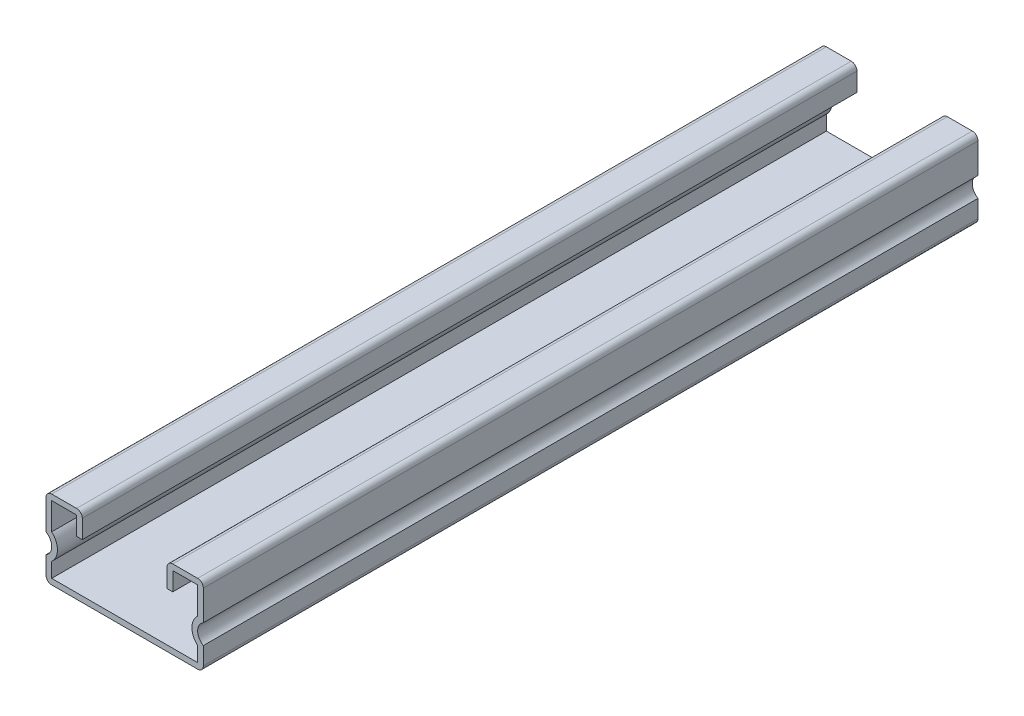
SolidWorks part; units mm, degrees
ref_plane "Plane1" through (0, 0, 0) normal (0, 0, 1) x (1, 0, 0)
ref_plane "Plane2" through (0, 0, 0) normal (0, 1, 0) x (1, 0, 0)
ref_plane "Plane3" through (0, 0, 0) normal (1, 0, 0) x (0, 0, -1)
sketch "Sketch1" plane through (0, 0, 0) normal (0, 0, 1) x (1, 0, 0)
  line L0 (-20.6375, 10.4394) -> (-20.6375, 2.5957)
  line L1 (-20.6375, -2.5957) -> (-20.6375, -7.2136)
  line L2 (-19.1389, -8.7122) -> (19.1389, -8.7122)
  line L3 (20.6375, -7.2136) -> (20.6375, -2.5957)
  line L4 (20.6375, 2.5957) -> (20.6375, 10.4394)
  line L5 (19.1389, 11.938) -> (12.6111, 11.938)
  line L6 (11.1125, 10.4394) -> (11.1125, 5.588)
  line L7 (-19.1389, 11.938) -> (-12.6111, 11.938)
  line L8 (-11.1125, 10.4394) -> (-11.1125, 5.588)
  line L9 (19.1389, -5.2823) -> (19.1389, 6.4389) construction
  line L10 (-19.1389, 6.4389) -> (-19.1389, -5.2823) construction
  line L11 (-12.6111, 10.4394) -> (-12.6111, 5.588)
  line L12 (-19.1389, 10.4394) -> (-12.6111, 10.4394)
  line L13 (-19.1389, 10.4394) -> (-19.1389, 3.351)
  line L14 (-19.1389, -3.351) -> (-19.1389, -7.2136)
  line L15 (-19.1389, -7.2136) -> (19.1389, -7.2136)
  line L16 (19.1389, -7.2136) -> (19.1389, -3.351)
  line L17 (19.1389, 3.351) -> (19.1389, 10.4394)
  line L18 (19.1389, 10.4394) -> (12.6111, 10.4394)
  line L19 (12.6111, 10.4394) -> (12.6111, 5.588)
  line L20 (-12.6111, 5.588) -> (-11.1125, 5.588)
  line L21 (11.1125, 5.588) -> (12.6111, 5.588)
  arc A0 (20.6375, 2.5957) -> (20.6375, -2.5957) centre (22.1361, 0) ccw
  arc A1 (-20.6375, -2.5957) -> (-20.6375, 2.5957) centre (-22.1361, 0) ccw
  arc A2 (-12.6111, 11.938) -> (-11.1125, 10.4394) centre (-12.6111, 10.4394) cw
  arc A3 (-20.6375, 10.4394) -> (-19.1389, 11.938) centre (-19.1389, 10.4394) cw
  arc A4 (-19.1389, -8.7122) -> (-20.6375, -7.2136) centre (-19.1389, -7.2136) cw
  arc A5 (20.6375, -7.2136) -> (19.1389, -8.7122) centre (19.1389, -7.2136) cw
  arc A6 (19.1389, 11.938) -> (20.6375, 10.4394) centre (19.1389, 10.4394) cw
  arc A7 (11.1125, 10.4394) -> (12.6111, 11.938) centre (12.6111, 10.4394) cw
  arc A8 (-19.1389, -3.351) -> (-19.1389, 3.351) centre (-22.1361, 0) ccw
  arc A9 (19.1389, 3.351) -> (19.1389, -3.351) centre (22.1361, 0) ccw
  dimension "D1" = 20.6375
  dimension "D9" = 2.9972
  dimension "D10" = 2.9972
  dimension "Width" = 41.275
  dimension "base" = 8.7122
  dimension "ToeHt" = 11.938
  dimension "D6" = 22.225
  dimension "edge" = 9.525
  dimension "Lip" = 6.35
  dimension "gauge" = 1.4986
extrude "Base-Extrude" add sketch "Sketch1" along normal blind 203.2
extrude "Slot" cut sketch "Sketch2" against normal through all
sketch "Sketch2" plane through (-0.7476, -8.7122, -11.6779) normal (0, -1, 0) x (1, 0, 0)
  line L0 (5.907, 90.2591) -> (5.907, 24.3779)
  line L1 (-4.4118, 24.3779) -> (-4.4118, 90.2591)
  arc A0 (-4.4118, 24.3779) -> (5.907, 24.3779) centre (0.7476, 24.3779) ccw
  arc A1 (5.907, 90.2591) -> (-4.4118, 90.2591) centre (0.7476, 90.2591) ccw
  dimension "D3" = 10.3187
  dimension "D1" = 12.7
  dimension "D2" = 65.8813
pattern_linear "LPattern1" count 2 spacing 101.6 along (0, 0, 1) of "Slot"
equation "\"D1@Sketch1\" = \"Width@Sketch1\" / 2"
equation "\"D6@Sketch1\" = \"Width@Sketch1\" - 2 * \"edge@Sketch1\""
equation "\"D10@Sketch1\" = 2 * \"gauge@Sketch1\""
equation "\"D9@Sketch1\" = \"D10@Sketch1\""
equation "\"D1@LPattern1\" = \"D1@Base-Extrude\" / \"D3@LPattern1\""
